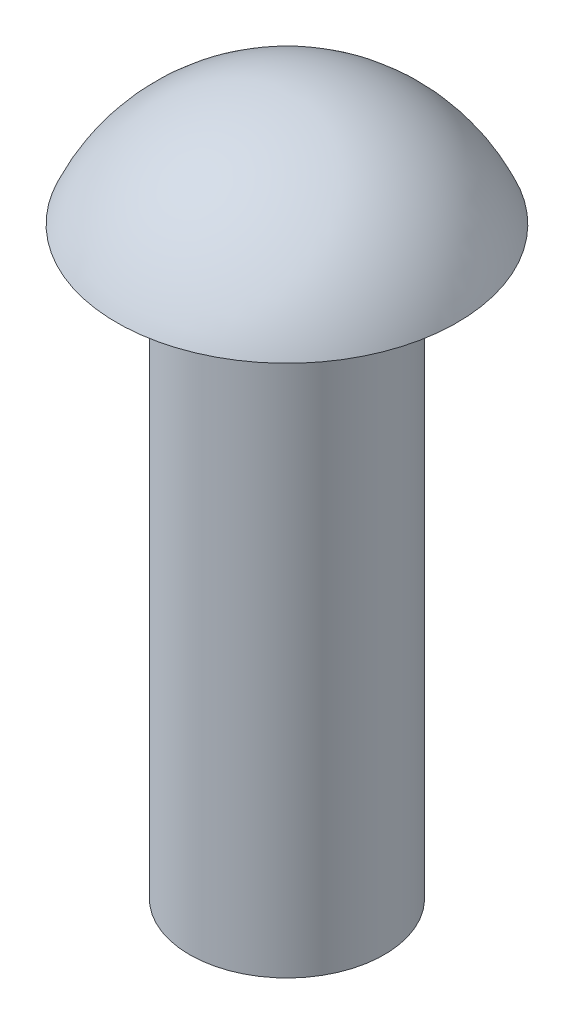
SolidWorks part; units mm, degrees
ref_plane "Front" through (0, 0, 0) normal (0, 0, 1) x (1, 0, 0)
ref_plane "Top" through (0, 0, 0) normal (0, 1, 0) x (1, 0, 0)
ref_plane "Right" through (0, 0, 0) normal (1, 0, 0) x (0, 0, -1)
sketch "Sketch1" plane through (0, 0, 0) normal (1, 0, 0) x (0, 0, -1)
  line L0 (0, 0) -> (3.5, 0)
  line L1 (0, -3.1053) -> (0, 6.0115) construction
  line L2 (0, 2.3201) -> (0, 0)
  arc A0 (3.5, 0) -> (0, 2.3201) centre (0, -1.4799) ccw
  dimension "D1" = 3.8
  dimension "D2" = 7
revolve "Revolve1" add sketch "Sketch1" angle 360 about L1
sketch "Sketch2" plane through (0, 0, 0) normal (0, -1, 0) x (1, 0, 0)
  circle A0 centre (0, 0) radius 2
  dimension "D1" = 4
extrude "Extrude1" add sketch "Sketch2" along normal blind 12
sketch "Sketch3" plane through (0, 0, 0) normal (0, 0, 1) x (1, 0, 0)
  line L0 (-2, -12) -> (2, -12) construction
  line L1 (-2, -12) -> (2, -12)
  line L2 (-2, -12) -> (-2, -4)
  line L3 (-2, -4) -> (2, -4)
  line L4 (2, -12) -> (2, -4)
  line L6 (2, -12) -> (2, 0) construction
  line L7 (-2, 0) -> (-2, -12) construction
  line L8 (-3.5, 0) -> (3.5, 0) construction
  line L9 (-4.0574, -2) -> (3.8786, -2) construction
  dimension "D1" = 4
extrude "Cut-Extrude1" cut sketch "Sketch3" against normal up to next and the other way up to next
ref_plane "Plane1" through (0, -2, 0) normal (0, -1, 0) x (1, 0, 0)
mirror "Mirror1" about plane through (0, -2, 0) normal (0, -1, 0)
